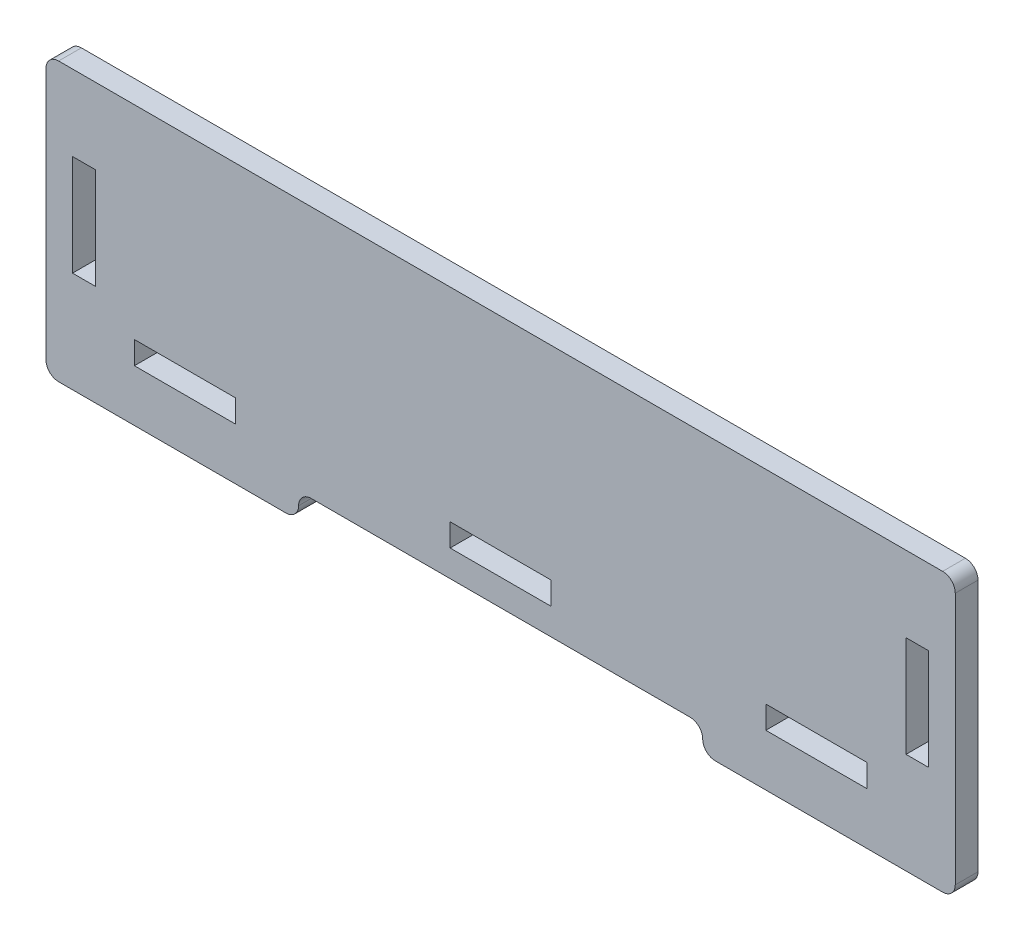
SolidWorks part; units mm, degrees
ref_plane "Piano frontale" through (0, 0, 0) normal (0, 0, 1) x (1, 0, 0)
ref_plane "Piano superiore" through (0, 0, 0) normal (0, 1, 0) x (1, 0, 0)
ref_plane "Piano destro" through (0, 0, 0) normal (1, 0, 0) x (0, 0, -1)
sketch "Schizzo1" plane through (0, 0, 0) normal (0, 0, 1) x (1, 0, 0)
  line L1 (-360, 100) -> (360, 100)
  line L2 (-360, 100) -> (-360, -100)
  line L3 (-360, -100) -> (360, -100)
  line L4 (360, 100) -> (360, -100)
  line L5 (-360, 100) -> (360, -100) construction
  line L6 (-360, -100) -> (360, 100) construction
  point P0 (0, 0)
  dimension "D1" = 200
  dimension "D2" = 720
extrude "Estrusione-Estrusione1" add sketch "Schizzo1" along normal blind 18
sketch "Schizzo2" plane through (0, 0, 18) normal (0, 0, 1) x (1, 0, 0)
  line L0 (0, 100) -> (0, -100) construction
  line L1 (-360, -100) -> (-160, -100)
  line L2 (-360, -100) -> (-360, -120)
  line L3 (-360, -120) -> (-160, -120)
  line L4 (-160, -100) -> (-160, -120)
  line L5 (360, 100) -> (-360, 100) construction
  line L6 (-360, -100) -> (360, -100) construction
  line L7 (160, -100) -> (160, -120)
  line L8 (360, -120) -> (160, -120)
  line L9 (360, -100) -> (360, -120)
  line L10 (360, -100) -> (160, -100)
  dimension "D1" = 20
  dimension "D2" = 200
extrude "Estrusione-Estrusione2" add sketch "Schizzo2" against normal blind 18
fillet "Raccordo1" radius 10 6 edges at (160, -120, 9) (160, -100, 9) (-160, -120, 9) (-160, -100, 9) (360, -120, 9) (-360, -120, 9)
sketch "Schizzo4" plane through (0, 0, 18) normal (0, 0, 1) x (1, 0, 0)
  line L0 (-360, -70) -> (360, -70) construction
  line L1 (-290, -61) -> (-210, -61)
  line L2 (-290, -61) -> (-290, -79)
  line L3 (-290, -79) -> (-210, -79)
  line L4 (-210, -61) -> (-210, -79)
  line L5 (-290, -61) -> (-210, -79) construction
  line L6 (-290, -79) -> (-210, -61) construction
  line L7 (-360, 100) -> (-360, -110) construction
  line L8 (360, -110) -> (360, 100) construction
  line L9 (-350, -120) -> (-170, -120) construction
  line L10 (0, 100) -> (0, -100) construction
  line L11 (360, 100) -> (-360, 100) construction
  line L12 (-150, -100) -> (150, -100) construction
  line L13 (290, -79) -> (210, -61) construction
  line L14 (290, -61) -> (210, -79) construction
  line L15 (210, -61) -> (210, -79)
  line L16 (290, -79) -> (210, -79)
  line L17 (290, -61) -> (290, -79)
  line L18 (290, -61) -> (210, -61)
  line L19 (-360, 0) -> (360, 0) construction
  line L20 (-40, -61) -> (40, -61)
  line L21 (-40, -61) -> (-40, -79)
  line L22 (-40, -79) -> (40, -79)
  line L23 (40, -61) -> (40, -79)
  line L24 (-40, -61) -> (40, -79) construction
  line L25 (-40, -79) -> (40, -61) construction
  line L26 (321, -40) -> (339, 40) construction
  line L27 (-321, 40) -> (-339, 40)
  line L28 (-321, 40) -> (-321, -40)
  line L29 (-321, -40) -> (-339, -40)
  line L30 (-339, 40) -> (-339, -40)
  line L31 (-321, 40) -> (-339, -40) construction
  line L32 (-321, -40) -> (-339, 40) construction
  line L33 (321, 40) -> (339, -40) construction
  line L34 (339, 40) -> (339, -40)
  line L35 (321, -40) -> (339, -40)
  line L36 (321, 40) -> (321, -40)
  line L37 (321, 40) -> (339, 40)
  point P0 (-250, -70)
  point P23 (250, -70)
  point P24 (0, -70)
  point P32 (-330, 0)
  point P41 (330, 0)
  dimension "D1" = 50
  dimension "D2" = 80
  dimension "D3" = 18
  dimension "D4" = 110
  dimension "D5" = 30
extrude "Taglio-Estrusione1" cut sketch "Schizzo4" against normal blind 18
sketch "Schizzo5" [suppressed] plane through (0, 0, 18) normal (0, 0, 1) x (1, 0, 0)
  line L0 (360, -110) -> (360, 100) construction
  line L1 (-360, 100) -> (360, 100)
  line L2 (-360, 100) -> (-360, 580)
  line L3 (-360, 580) -> (360, 580)
  line L4 (360, 100) -> (360, 580)
  line L5 (-350, -120) -> (-170, -120) construction
  dimension "D1" = 700
extrude "Estrusione-Estrusione3" [suppressed] add sketch "Schizzo5" against normal blind 18
sketch "Schizzo6" [suppressed] plane through (0, 0, 18) normal (0, 0, 1) x (1, 0, 0)
  line L0 (0, 580) -> (0, -100) construction
  line L1 (-339, 270) -> (-321, 270)
  line L2 (-339, 270) -> (-339, 190)
  line L3 (-339, 190) -> (-321, 190)
  line L4 (-321, 270) -> (-321, 190)
  line L5 (-339, 270) -> (-321, 190) construction
  line L6 (-339, 190) -> (-321, 270) construction
  line L7 (360, 580) -> (-360, 580) construction
  line L8 (-150, -100) -> (150, -100) construction
  line L9 (-330, -120) -> (-330, 580) construction
  line L10 (-350, -120) -> (-170, -120) construction
  line L11 (-360, 580) -> (-360, -110) construction
  line L12 (-321, 40) -> (-339, 40) construction
  line L13 (-339, 40) -> (-339, -40) construction
  line L14 (-330, 230) -> (360, 230) construction
  line L15 (360, -110) -> (360, 580) construction
  line L16 (339, 420) -> (321, 500) construction
  line L17 (-339, 500) -> (-321, 500)
  line L18 (-339, 500) -> (-339, 420)
  line L19 (-339, 420) -> (-321, 420)
  line L20 (-321, 500) -> (-321, 420)
  line L21 (-339, 500) -> (-321, 420) construction
  line L22 (-339, 420) -> (-321, 500) construction
  line L23 (339, 500) -> (321, 420) construction
  line L24 (339, 190) -> (321, 270) construction
  line L25 (339, 270) -> (321, 190) construction
  line L26 (321, 500) -> (321, 420)
  line L27 (339, 420) -> (321, 420)
  line L28 (339, 500) -> (339, 420)
  line L29 (339, 500) -> (321, 500)
  line L30 (321, 270) -> (321, 190)
  line L31 (339, 190) -> (321, 190)
  line L32 (339, 270) -> (339, 190)
  line L33 (339, 270) -> (321, 270)
  point P0 (-330, 230)
  point P17 (-330, 460)
  point P19 (-330, 230)
  point P39 (330, 460)
  point P40 (330, 230)
  dimension "D1" = 30
  dimension "D2" = 80
extrude "Taglio-Estrusione2" [suppressed] cut sketch "Schizzo6" against normal blind 18
fillet "Raccordo2" radius 10 2 edges at (360, 100, 9) (-360, 100, 9)
fillet "Raccordo3" [suppressed] radius 10
